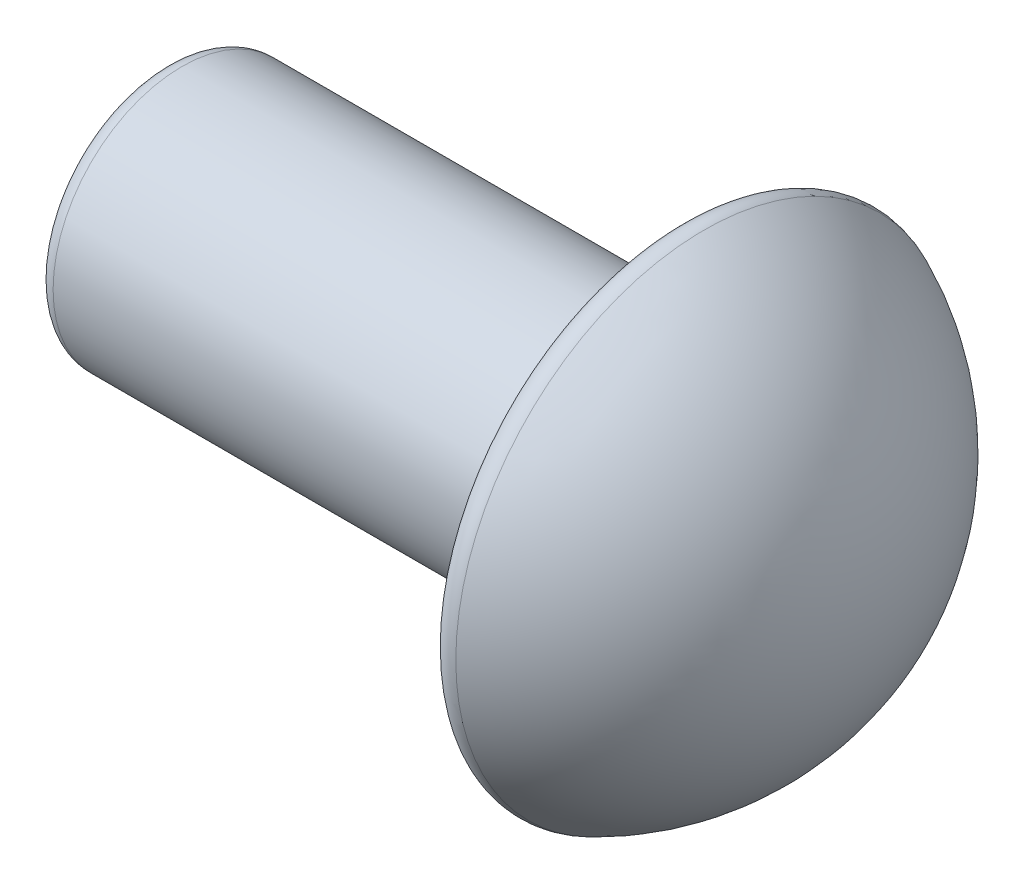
SolidWorks part; units mm, degrees
ref_plane "Face" through (0, 0, 0) normal (0, 0, 1) x (1, 0, 0)
ref_plane "Dessus" through (0, 0, 0) normal (0, 1, 0) x (1, 0, 0)
ref_plane "Droite" through (0, 0, 0) normal (1, 0, 0) x (0, 0, -1)
sketch "Esquisse1" plane through (0, 0, 0) normal (0, 0, 1) x (1, 0, 0)
  line L0 (0, 0) -> (0, 1.5)
  line L1 (0, 1.5) -> (6, 1.5)
  line L2 (6, 1.5) -> (6, 3)
  line L3 (0, 0) -> (8.1623, 0)
  line L4 (0, 0) -> (-90.1041, 0) construction
  arc A0 (8.1623, 0) -> (6, 3) centre (5, 0) ccw
  dimension "D1" = 3
  dimension "D2" = 3
  dimension "D3" = 5
  dimension "D4" = 6
revolve "Révolution1" add sketch "Esquisse1" angle 360 about L4
fillet "Congé1" radius 0.2
